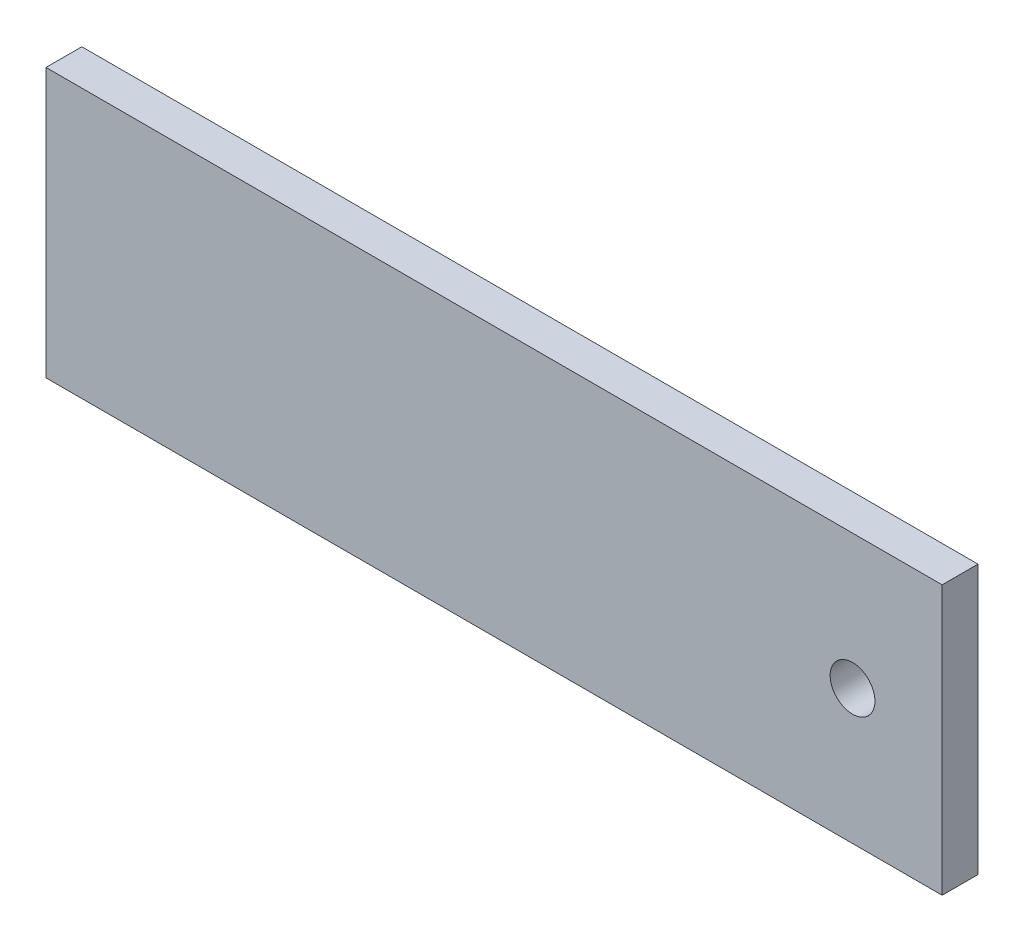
SolidWorks part; units mm, degrees
ref_plane "Plan de face" through (0, 0, 0) normal (0, 0, 1) x (1, 0, 0)
ref_plane "Plan de dessus" through (0, 0, 0) normal (0, 1, 0) x (1, 0, 0)
ref_plane "Plan de droite" through (0, 0, 0) normal (1, 0, 0) x (0, 0, -1)
sketch "Esquisse1" plane through (0, 0, 0) normal (0, 0, 1) x (1, 0, 0)
  line L1 (0, 0) -> (100, 0)
  line L4 (100, 0) -> (100, -30)
  line L5 (100, -30) -> (0, -30)
  line L6 (0, -30) -> (0, 0)
  dimension "D1" = 100
  dimension "D2" = 30
extrude "Extrusion1" add sketch "Esquisse1" along normal mid plane 4
hole_wizard "Trou taraudé M61" positions "Esquisse3" profile "Esquisse2" tap size "M6" standard "ISO"
sketch "Esquisse3" plane through (0, 0, 2) normal (0, 0, 1) x (1, 0, 0)
  line L1 (0, -30) -> (100, -30) construction
  line L2 (100, -30) -> (100, 0) construction
  point P0 (90, -15)
  dimension "D1" = 10
  dimension "D2" = 15
sketch "Esquisse2" plane through (90, -15, 2) normal (1, 0, 0) x (0, -1, 0)
  line L0 (0, 0) -> (0, 4)
  line L1 (0, 4) -> (2.5, 4)
  line L2 (2.5, 4) -> (2.5, 0)
  line L5 (2.5, 0) -> (0, 0)
  line L11 (0, -6.35) -> (0, 107.95) construction
  dimension "Diamètre du trou pour taraudage jusqu'au prochain" = 5
  dimension "Profondeur du trou pour taraudage jusqu'au prochain" = 4
